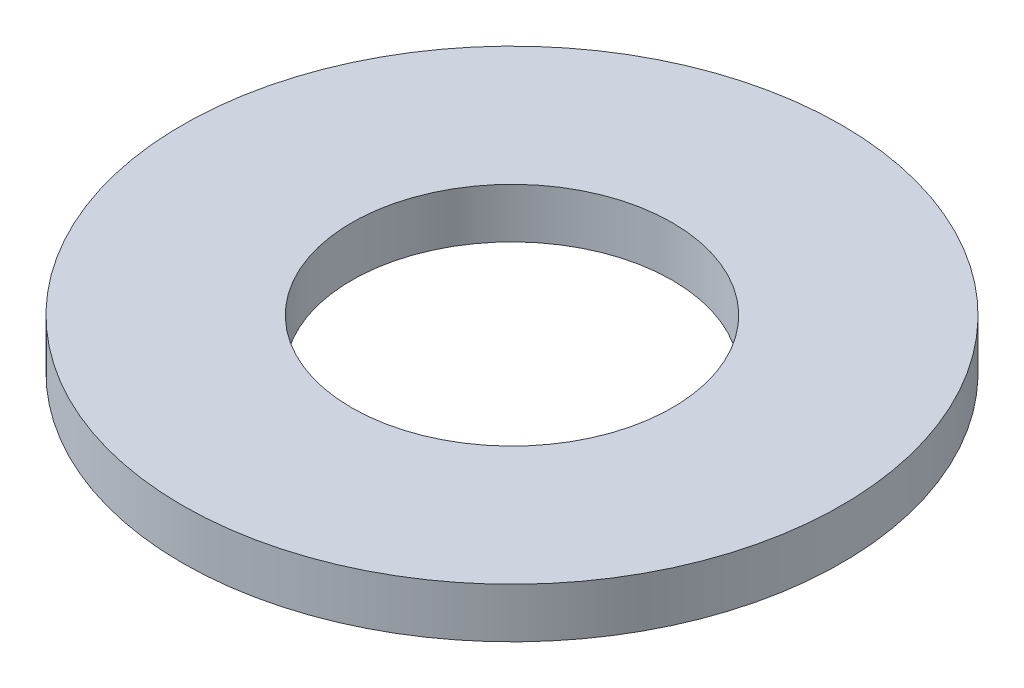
SolidWorks part; units mm, degrees
ref_plane "Front" through (0, 0, 0) normal (0, 0, 1) x (1, 0, 0)
ref_plane "Top" through (0, 0, 0) normal (0, 1, 0) x (1, 0, 0)
ref_plane "Right" through (0, 0, 0) normal (1, 0, 0) x (0, 0, -1)
sketch "Sketch1" plane through (0, 0, 0) normal (0, 1, 0) x (1, 0, 0)
  circle A0 centre (0, 0) radius 4.699
  dimension "D1" = 9.398
extrude "Extrude1" add sketch "Sketch1" along normal blind 0.7112
sketch "Sketch2" plane through (0, 0, 0) normal (0, -1, 0) x (1, 0, 0)
  circle A0 centre (0, 0) radius 2.286
  dimension "D1" = 4.572
extrude "Cut-Extrude1" cut sketch "Sketch2" against normal through all
